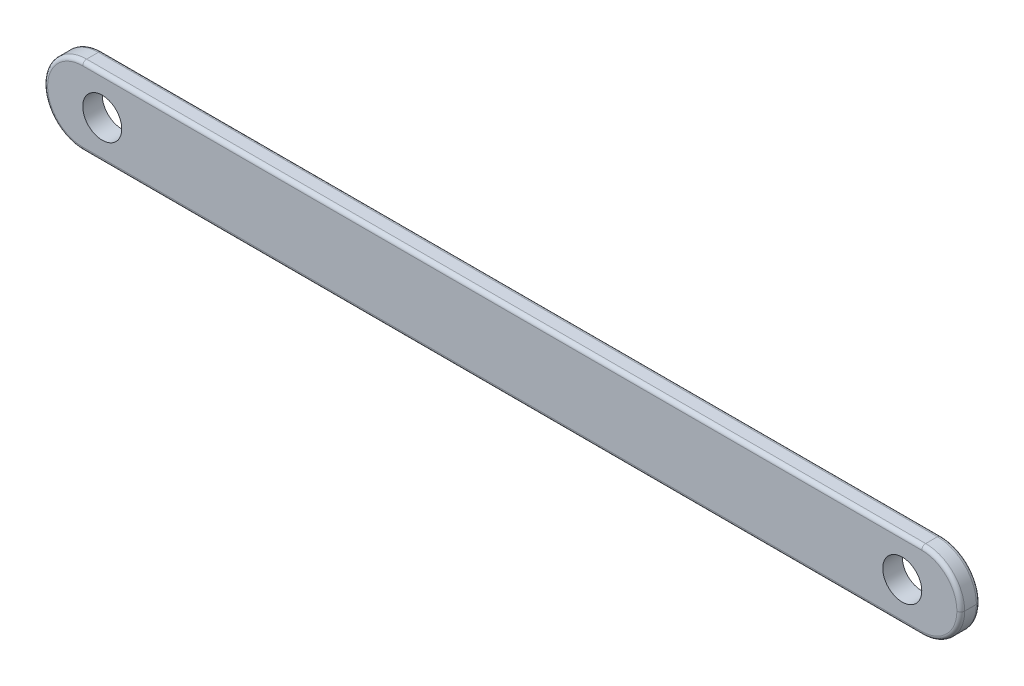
SolidWorks part; units mm, degrees
ref_plane "Alzado" through (0, 0, 0) normal (0, 0, 1) x (1, 0, 0)
ref_plane "Planta" through (0, 0, 0) normal (0, 1, 0) x (1, 0, 0)
ref_plane "Vista lateral" through (0, 0, 0) normal (1, 0, 0) x (0, 0, -1)
sketch "Croquis1" plane through (0, 0, 0) normal (0, 0, 1) x (1, 0, 0)
  line L1 (0, 0) -> (-235.02, 0)
  line L2 (0, 0) -> (0, 20)
  line L3 (0, 20) -> (-235.02, 20)
  line L4 (-235.02, 0) -> (-235.02, 20)
  circle A0 centre (-220.02, 10) radius 5
  circle A1 centre (-15, 10) radius 5
  point P10 (0, 10)
  dimension "D2" = 10
  dimension "D3" = 10
  dimension "D1" = 15
  dimension "D4" = 205.02
  dimension "D5" = 15
  dimension "D6" = 20
extrude "Saliente-Extruir1" add sketch "Croquis1" along normal blind 5
fillet "Redondeo1" radius 10 4 edges at (0, 0, 2.5) (0, 20, 2.5) (-235.02, 0, 2.5) (-235.02, 20, 2.5)
fillet "Redondeo2" radius 1 12 edges at (-2.9289, 17.0711, 0) (-2.9289, 2.9289, 0) (-117.51, 0, 0) (-232.0911, 2.9289, 0) (-232.0911, 17.0711, 0) (-2.9289, 17.0711, 5) (-2.9289, 2.9289, 5) (-232.0911, 2.9289, 5) (-232.0911, 17.0711, 5) (-117.51, 20, 0) (-117.51, 0, 5) (-117.51, 20, 5)
